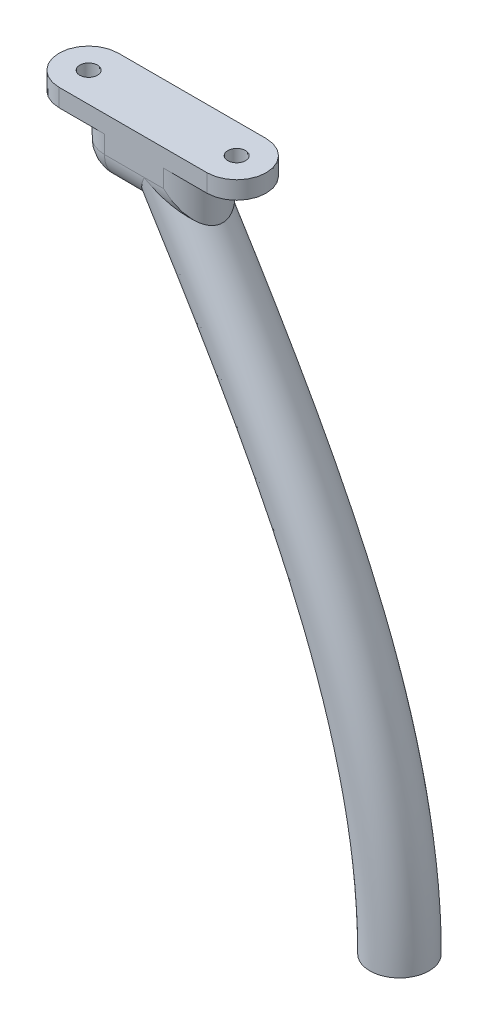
SolidWorks part; units mm, degrees
ref_plane "前视基准面" through (0, 0, 0) normal (0, 0, 1) x (1, 0, 0)
ref_plane "上视基准面" through (0, 0, 0) normal (0, 1, 0) x (1, 0, 0)
ref_plane "右视基准面" through (0, 0, 0) normal (1, 0, 0) x (0, 0, -1)
other "Configuration Table"
sketch "草图1" plane through (0, 0, 0) normal (0, 1, 0) x (1, 0, 0)
  line L0 (0, 0) -> (25, 0) construction
  line L1 (0, 0) -> (25, 0) construction
  line L2 (0, 5) -> (25, 5)
  line L3 (0, -5) -> (25, -5)
  circle A0 centre (0, 0) radius 1.5
  circle A1 centre (25, 0) radius 1.5
  arc A2 (0, 5) -> (0, -5) centre (0, 0) ccw
  arc A3 (25, -5) -> (25, 5) centre (25, 0) ccw
  point P6 (12.5, 0)
  dimension "D1" = 25
  dimension "D2" = 5
extrude "凸台-拉伸1" add sketch "草图1" along normal blind 3
sketch "草图3" plane through (0, 0, 0) normal (0, -1, 0) x (1, 0, 0)
  circle A0 centre (12.5, 0) radius 4
ref_plane "基准面1" through (0, -100, 0) normal (0, -1, 0) x (-1, 0, 0)
sketch "草图4" plane through (0, -100, 0) normal (0, -1, 0) x (-1, 0, 0)
  circle A0 centre (-52.5, 0) radius 4
  dimension "D1" = 40
loft "放样-薄件1" add profiles "草图4", "草图3" parameters "D1"=1, "D2"=1
sketch "草图5" plane through (0, 3, 0) normal (0, 1, 0) x (1, 0, 0)
  line L0 (17.6473, 0) -> (7.6473, 0) construction
  line L1 (17.6473, -5) -> (7.6473, -5)
  line L2 (17.6473, 5) -> (7.6473, 5)
  arc A1 (17.6473, -5) -> (17.6473, 5) centre (17.6473, 0) ccw
  arc A2 (7.6473, 5) -> (7.6473, -5) centre (7.6473, 0) ccw
  point P2 (12.6473, 0)
  dimension "D1" = 5
  dimension "D2" = 10
extrude "凸台-拉伸2" add sketch "草图5" against normal blind 11
fillet "圆角3" radius 5 3 edges at (12.6473, -8, -5) (12.6473, -8, 5) (2.6473, -8, 0)
